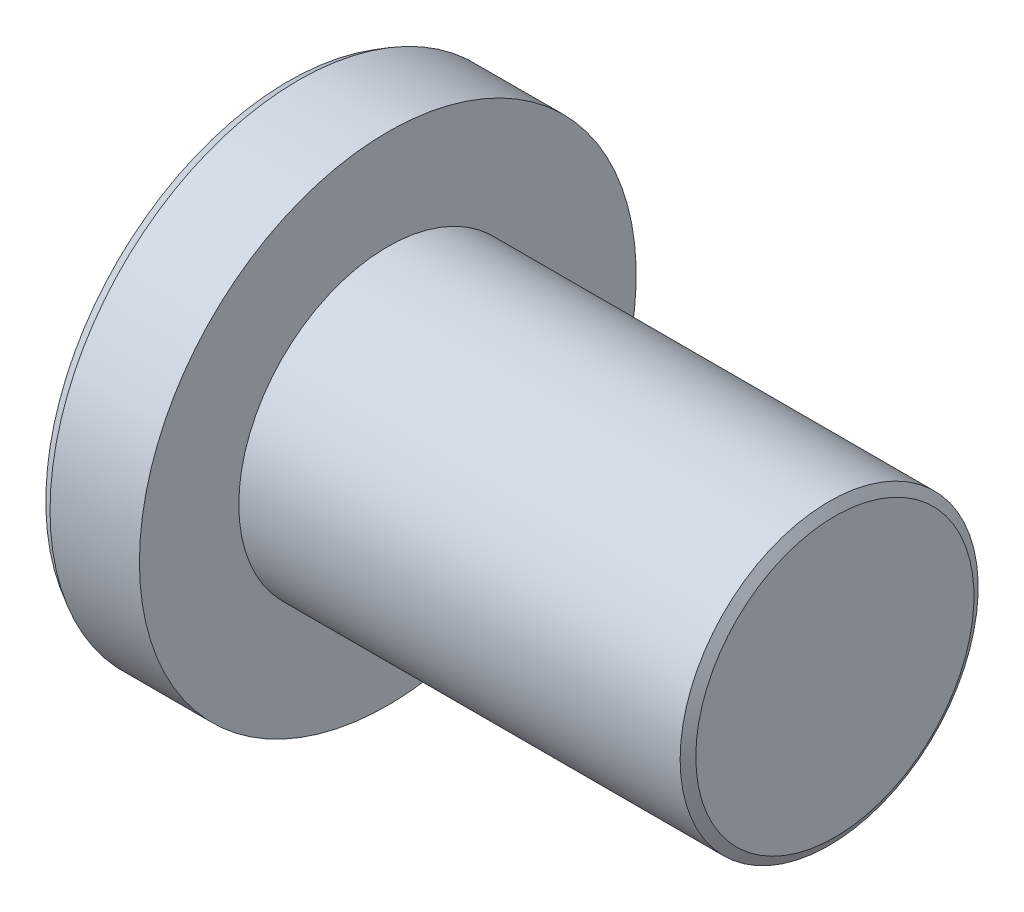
SolidWorks part; units mm, degrees
ref_plane "Plan de face" through (0, 0, 0) normal (0, 0, 1) x (1, 0, 0)
ref_plane "Plan de dessus" through (0, 0, 0) normal (0, 1, 0) x (1, 0, 0)
ref_plane "Plan de droite" through (0, 0, 0) normal (1, 0, 0) x (0, 0, -1)
sketch "Esquisse1" plane through (0, 0, 0) normal (0, 0, 1) x (1, 0, 0)
  line L0 (-45.6598, 0) -> (47.9542, 0) construction
  line L1 (0, 0) -> (0, 25)
  line L2 (0, 25) -> (10, 25)
  line L3 (10, 25) -> (10, 15)
  line L4 (10, 15) -> (55, 15)
  line L5 (55, 15) -> (55, 0)
  line L6 (0, 0) -> (55, 0)
  dimension "D1" = 25
  dimension "D2" = 15
  dimension "D3" = 10
  dimension "D4" = 55
revolve "Révolution1" add sketch "Esquisse1" angle 360 about L0
chamfer "Chanfrein1" distance 1 angle 30 2 edges at (55, 0, 15) (0, 0, 25)
